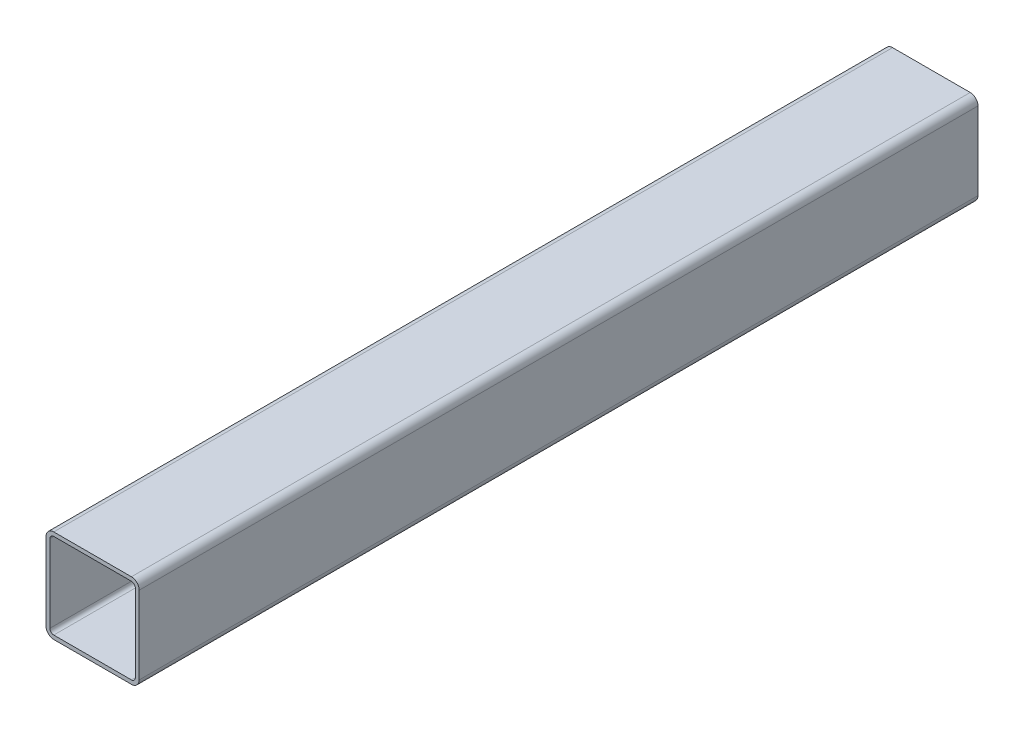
SolidWorks part; units mm, degrees
ref_plane "Front Plane" through (0, 0, 0) normal (1, 0, 0) x (0, 1, 0)
ref_plane "Top Plane" through (0, 0, 0) normal (0, 0, 1) x (0, 1, 0)
ref_plane "Right Plane" through (0, 0, 0) normal (0, 1, 0) x (-1, 0, 0)
sketch "6in beam" plane through (0, 0, 0) normal (0, 0, 1) x (0, 1, 0)
  point P0 (0, 0)
  line B0 (-63.5, -76.2) -> (63.5, -76.2)
  line B1 (-76.2, -63.5) -> (-76.2, 63.5)
  line B2 (63.5, 76.2) -> (-63.5, 76.2)
  line B3 (76.2, 63.5) -> (76.2, -63.5)
  line B4 (-63.5, 63.5) -> (63.5, -63.5) construction
  line B5 (69.85, 63.5) -> (69.85, -63.5)
  line B6 (-63.5, -69.85) -> (63.5, -69.85)
  line B7 (-69.85, -63.5) -> (-69.85, 63.5)
  line B8 (63.5, 69.85) -> (-63.5, 69.85)
  arc B9 (76.2, 63.5) -> (63.5, 76.2) centre (63.5, 63.5) ccw
  arc B10 (63.5, -76.2) -> (76.2, -63.5) centre (63.5, -63.5) ccw
  arc B11 (-76.2, -63.5) -> (-63.5, -76.2) centre (-63.5, -63.5) ccw
  arc B12 (-63.5, 76.2) -> (-76.2, 63.5) centre (-63.5, 63.5) ccw
  arc B13 (63.5, -69.85) -> (69.85, -63.5) centre (63.5, -63.5) ccw
  arc B14 (-69.85, -63.5) -> (-63.5, -69.85) centre (-63.5, -63.5) ccw
  arc B15 (-63.5, 69.85) -> (-69.85, 63.5) centre (-63.5, 63.5) ccw
  arc B16 (69.85, 63.5) -> (63.5, 69.85) centre (63.5, 63.5) ccw
sketch_block_instance "6in 0.25in beam-1"
sketch_block "6in 0.25in beam" parameters "D1"=12.7, "D2"=152.4, "D3"=152.4
extrude "Beam 6in" add sketch "6in beam" along normal blind 152.4 and the other way blind 1219.2
sketch "Sketch2"
sketch_block_instance "Hex Plate 6in-1"
sketch_block "Hex Plate 6in"
